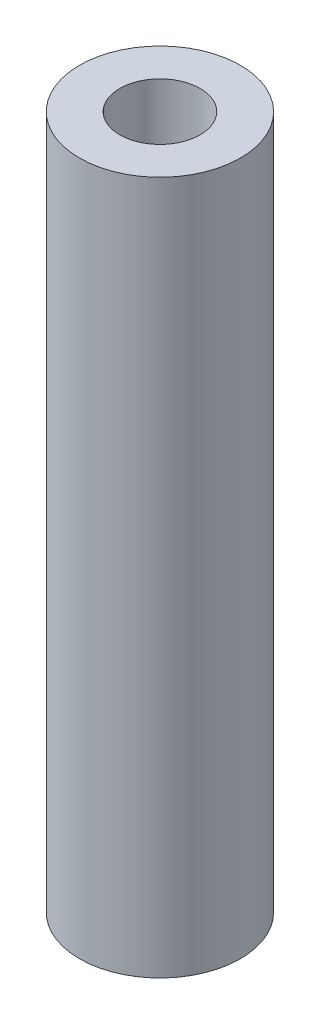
SolidWorks part; units mm, degrees
ref_plane "Front Plane" through (0, 0, 0) normal (0, 0, 1) x (1, 0, 0)
ref_plane "Top Plane" through (0, 0, 0) normal (0, 1, 0) x (1, 0, 0)
ref_plane "Right Plane" through (0, 0, 0) normal (1, 0, 0) x (0, 0, -1)
sketch "Sketch1" plane through (0, 0, 0) normal (0, 1, 0) x (1, 0, 0)
  circle A0 centre (0, 0) radius 8.128
  dimension "D1" = 16.256
extrude "Boss-Extrude1" add sketch "Sketch1" along normal blind 70.104
sketch "Sketch2" plane through (0, 70.104, 0) normal (0, 1, 0) x (1, 0, 0)
  circle A0 centre (0, 0) radius 4.064
  dimension "D1" = 8.128
extrude "Cut-Extrude1" cut sketch "Sketch2" against normal through all
